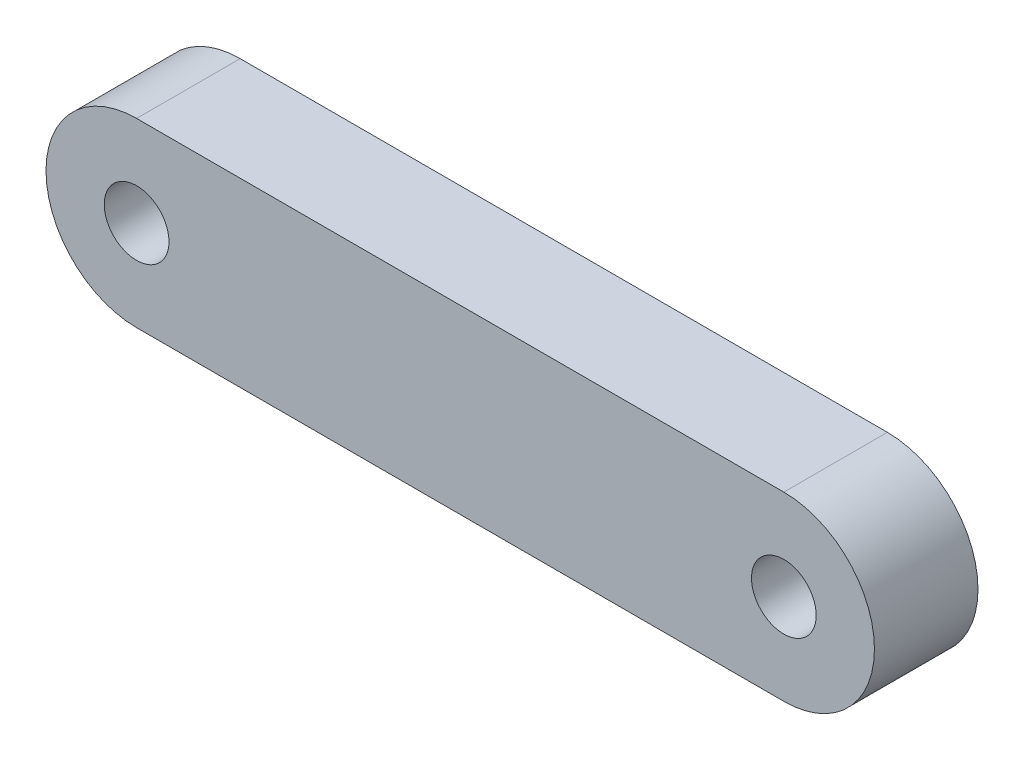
SolidWorks part; units mm, degrees
ref_plane "Front Plane" through (0, 0, 0) normal (0, 0, 1) x (1, 0, 0)
ref_plane "Top Plane" through (0, 0, 0) normal (0, 1, 0) x (1, 0, 0)
ref_plane "Right Plane" through (0, 0, 0) normal (1, 0, 0) x (0, 0, -1)
sketch "Sketch1" plane through (0, 0, 0) normal (0, 0, 1) x (1, 0, 0)
  line L0 (-44.45, -29.21) -> (-76.2, -29.21) construction
  line L1 (-44.45, -33.655) -> (-76.2, -33.655)
  line L2 (-44.45, -24.765) -> (-76.2, -24.765)
  arc A0 (-44.45, -33.655) -> (-44.45, -24.765) centre (-44.45, -29.21) ccw
  arc A1 (-76.2, -24.765) -> (-76.2, -33.655) centre (-76.2, -29.21) ccw
  point P3 (-60.325, -29.21)
extrude "Extrude1" add sketch "Sketch1" along normal blind 5.08
sketch "Sketch2" plane through (0, 0, 5.08) normal (0, 0, 1) x (1, 0, 0)
  circle A0 centre (-44.45, -29.21) radius 1.5875
  circle A1 centre (-76.2, -29.21) radius 1.5875
  dimension "D1" = 3.175
  dimension "D2" = 3.175
extrude "Cut-Extrude1" cut sketch "Sketch2" against normal through all
